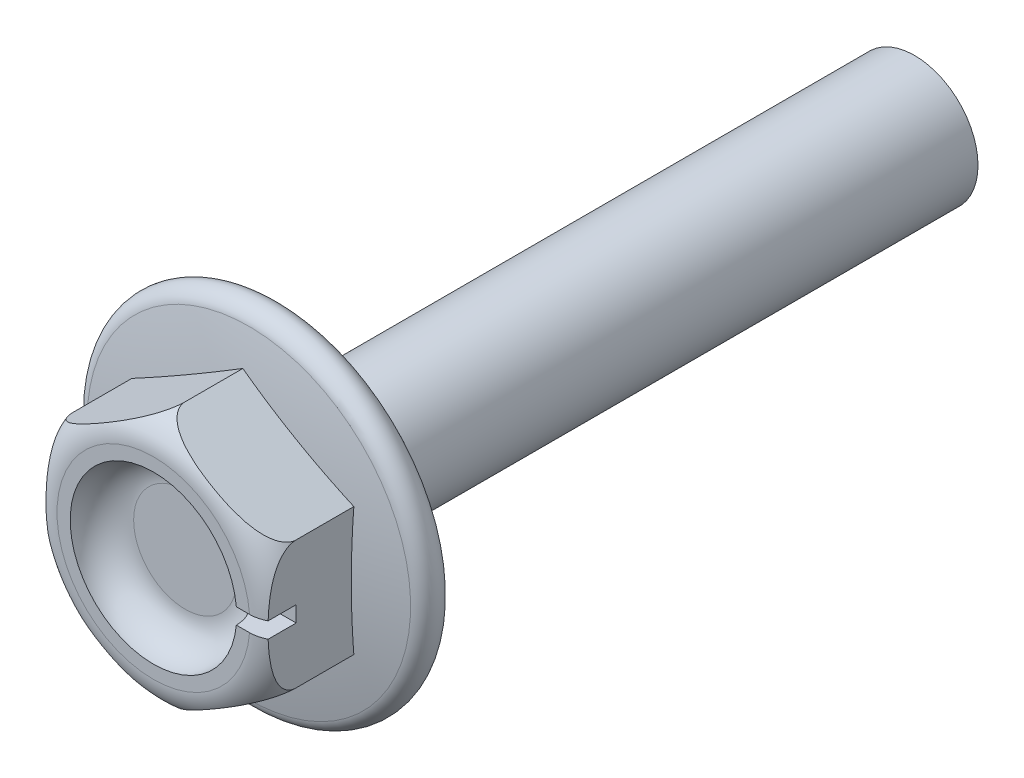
SolidWorks part; units mm, degrees
extrude "Shank" add sketch "Shank Sketch" against normal blind 20
sketch "Shank Sketch" plane through (0, 0, 0) normal (0, 0, 1) x (1, 0, 0)
  line L0 (50, 0) -> (-50, 0) construction
  line L1 (0, -50) -> (0, 50) construction
  circle A0 centre (0, 0) radius 2
  dimension "Shank diameter" = 4
extrude "Head" add sketch "Head Sketch" along normal blind 4
sketch "Head Sketch" plane through (0, 0, 0) normal (0, 0, 1) x (1, 0, 0)
  line L0 (0, 4.0415) -> (3.5, 2.0207)
  line L1 (3.5, 2.0207) -> (3.5, -2.0207)
  line L2 (3.5, -2.0207) -> (0, -4.0415)
  line L3 (0, -4.0415) -> (-3.5, -2.0207)
  line L4 (-3.5, -2.0207) -> (-3.5, 2.0207)
  line L5 (-3.5, 2.0207) -> (0, 4.0415)
  line L6 (3.5, 2.0207) -> (-3.5, -2.0207) construction
  line L7 (0, 4.0415) -> (0, -4.0415) construction
  line L8 (-3.5, 2.0207) -> (3.5, -2.0207) construction
  point P0 (0, 0)
  dimension "D1" = 60
  dimension "D2" = 60
  dimension "Width across flats" = 7
ref_plane "Plane1" through (0, 0, 0) normal (0, 0, 1) x (1, 0, 0)
ref_plane "Plane2" through (0, 0, 0) normal (0, 1, 0) x (-1, 0, 0)
ref_plane "Plane3" through (0, 0, 0) normal (1, 0, 0) x (0, 0, -1)
sketch "Sketch3" plane through (0, 0, 0) normal (0, 1, 0) x (-1, 0, 0)
  line L0 (0, 0) -> (0, 3) construction
  line L1 (0, -20) -> (0, 0) construction
  line L4 (-5, 0) -> (0, 0)
  line L5 (0, 0) -> (0, 1.5)
  arc A0 (0, 1.5) -> (-5.099, 0.9901) centre (0, -24.25) ccw
  arc A1 (-5, 0) -> (-5.099, 0.9901) centre (-5, 0.5) cw
  dimension "D1" = 0.5
  dimension "D2" = 10
  dimension "D3" = 1.5
revolve "Flange" add sketch "Sketch3" angle 360 about L0
sketch "Sketch5" plane through (0, 0, 0) normal (1, 0, 0) x (0, 0, -1)
  line L0 (-4, -3.0415) -> (-4, -4.0415)
  line L1 (-4, -4.0415) -> (-3, -4.0415)
  line L2 (-4, -4.0415) -> (-1.1809, -4.0415) construction
  line L3 (-4, -4.0415) -> (-4, -2.0207) construction
  line L5 (-15.0856, 0) -> (-8.1394, 0) construction
  line L6 (50, 0) -> (-50, 0) construction
  arc A0 (-4, -3.0415) -> (-3, -4.0415) centre (-3, -3.0415) ccw
  dimension "D1" = 1
revolve "Head Trim" cut sketch "Sketch5" angle 360 about L5
sketch "Sketch6" plane through (0, 0, 4) normal (0, 0, 1) x (1, 0, 0)
  circle A3 centre (0, 0) radius 2.625
extrude "Head Cut" cut sketch "Sketch6" against normal blind 1
fillet "Fillet1" radius 1 1 edges at (2.625, 0, 3)
sketch "Sketch8" plane through (0, 0, 4) normal (0, 0, 1) x (1, 0, 0)
  line L0 (0, 0) -> (3.5, 0) construction
  line L1 (3.5, -2.0207) -> (3.5, 2.0207) construction
  line L2 (0, 0.25) -> (0, -0.25)
  line L3 (0, -0.25) -> (3.5, -0.25)
  line L4 (3.5, -2.0207) -> (3.5, 2.0207) construction
  line L5 (0, 0.25) -> (3.5, 0.25)
  line L6 (3.5, -0.25) -> (3.5, 0.25)
  circle A0 centre (0, 0) radius 1.625 construction
  dimension "D1" = 0.5
extrude "Cut-Extrude3" cut sketch "Sketch8" against normal blind 1
equation "\"D1@Sketch6\" = \"Width across flats@Head Sketch\"*3/4"
